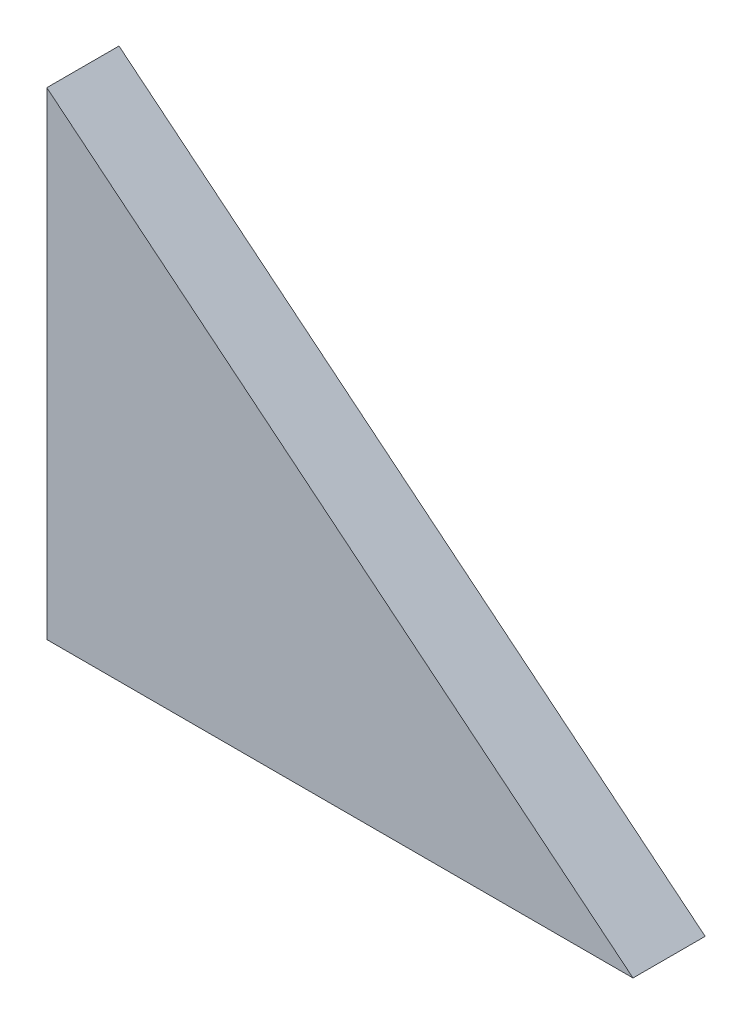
SolidWorks part; units mm, degrees
ref_plane "Plan de face" through (0, 0, 0) normal (0, 0, 1) x (1, 0, 0)
ref_plane "Plan de dessus" through (0, 0, 0) normal (0, 1, 0) x (1, 0, 0)
ref_plane "Plan de droite" through (0, 0, 0) normal (1, 0, 0) x (0, 0, -1)
sketch "Esquisse1" plane through (0, 0, 0) normal (0, 0, 1) x (1, 0, 0)
  line L0 (0, 0) -> (0, 53)
  line L1 (0, 53) -> (65, 0)
  line L2 (65, 0) -> (0, 0)
  dimension "D1" = 65
  dimension "D2" = 53
extrude "Extrusion1" add sketch "Esquisse1" along normal blind 8
